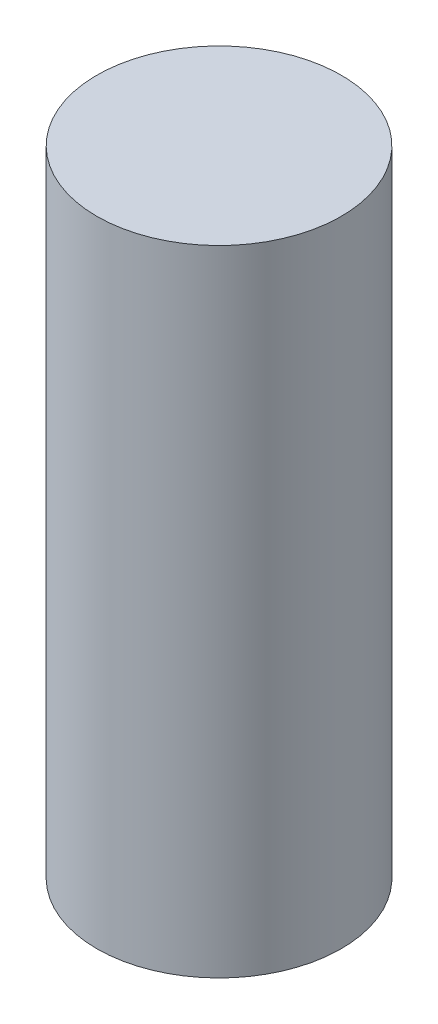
SolidWorks part; units mm, degrees
ref_plane "Front Plane" through (0, 0, 0) normal (0, 0, 1) x (1, 0, 0)
ref_plane "Top Plane" through (0, 0, 0) normal (0, 1, 0) x (1, 0, 0)
ref_plane "Right Plane" through (0, 0, 0) normal (1, 0, 0) x (0, 0, -1)
sketch "Sketch1" plane through (0, 0, 0) normal (0, 1, 0) x (1, 0, 0)
  circle A0 centre (0, 0) radius 9.25
  dimension "D1" = 18.5
extrude "Boss-Extrude1" add sketch "Sketch1" along normal blind 48
